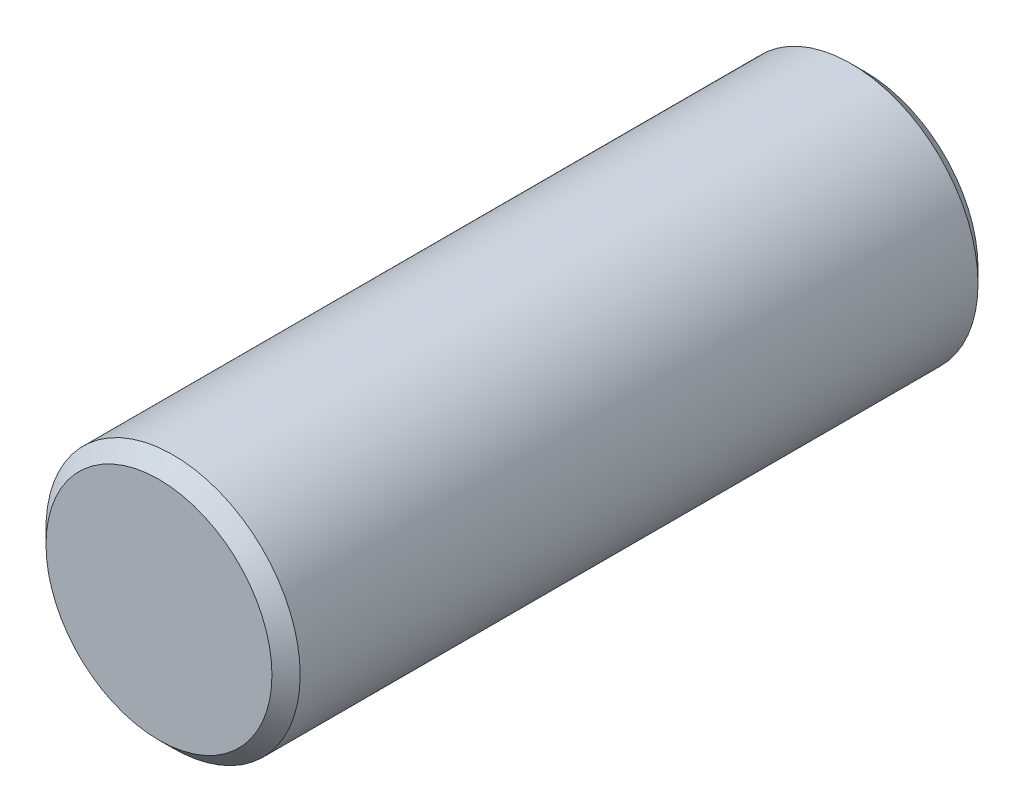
SolidWorks part; units mm, degrees
ref_plane "Plan de face" through (0, 0, 0) normal (0, 0, 1) x (1, 0, 0)
ref_plane "Plan de dessus" through (0, 0, 0) normal (0, 1, 0) x (1, 0, 0)
ref_plane "Plan de droite" through (0, 0, 0) normal (1, 0, 0) x (0, 0, -1)
sketch "Esquisse1" plane through (0, 0, 0) normal (0, 0, 1) x (1, 0, 0)
  circle A0 centre (0, 0) radius 9
  dimension "D1" = 18
extrude "Boss.-Extru.1" add sketch "Esquisse1" along normal blind 50
chamfer "Chanfrein1" distance 1 angle 45 2 edges at (9, 0, 0) (9, 0, 50)
